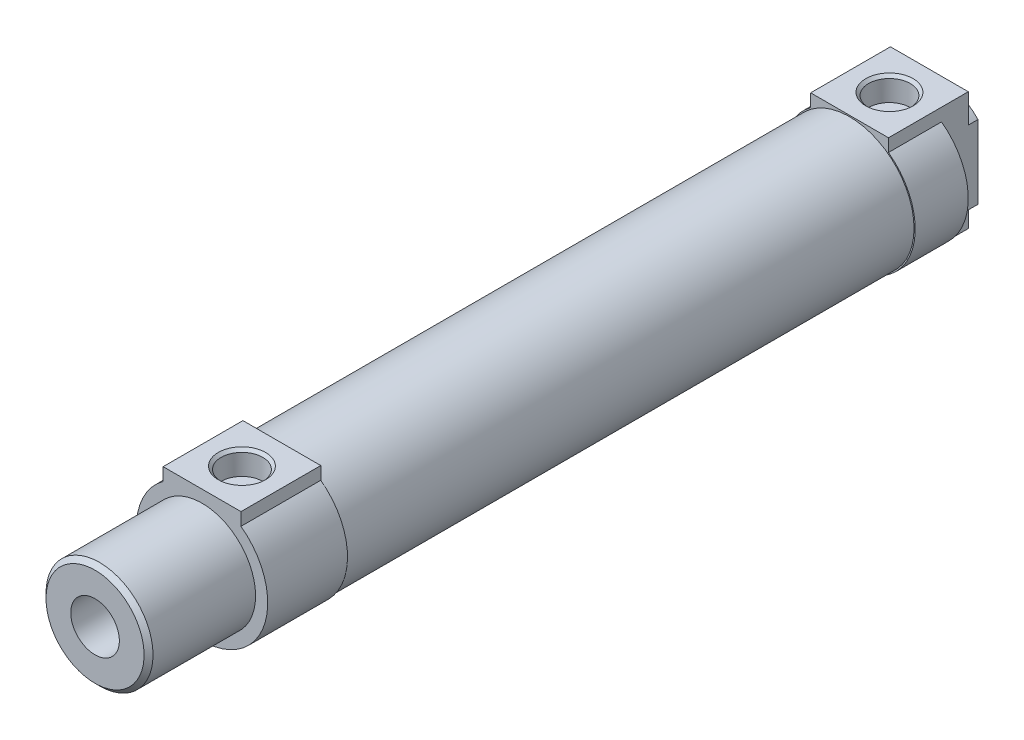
SolidWorks part; units mm, degrees
ref_plane "Plan de face" through (0, 0, 0) normal (0, 0, 1) x (1, 0, 0)
ref_plane "Plan de dessus" through (0, 0, 0) normal (0, 1, 0) x (1, 0, 0)
ref_plane "Plan de droite" through (0, 0, 0) normal (1, 0, 0) x (0, 0, -1)
imported_body "Importée1"
sketch "Esquisse2" plane through (0, 0, -171.5) normal (0, 0, -1) x (-1, 0, 0)
  line L0 (-8, -10.8743) -> (-8, 10.8743) construction
  line L1 (8, 10.8743) -> (8, -10.8743) construction
  line L2 (-8, -7.5498) -> (-8, 7.5498)
  line L3 (8, 7.5498) -> (8, -7.5498)
  line L4 (8, 7.5498) -> (8, 13.5) construction
  arc A0 (-8, -7.5498) -> (8, -7.5498) centre (0, 0) ccw construction
  arc A1 (8, 7.5498) -> (-8, 7.5498) centre (0, 0) ccw construction
  arc A2 (-8, -7.5498) -> (8, -7.5498) centre (0, 0) ccw
  arc A3 (8, 7.5498) -> (-8, 7.5498) centre (0, 0) ccw
extrude "Enlèv. mat.-Extru.1" cut sketch "Esquisse2" against normal blind 20
